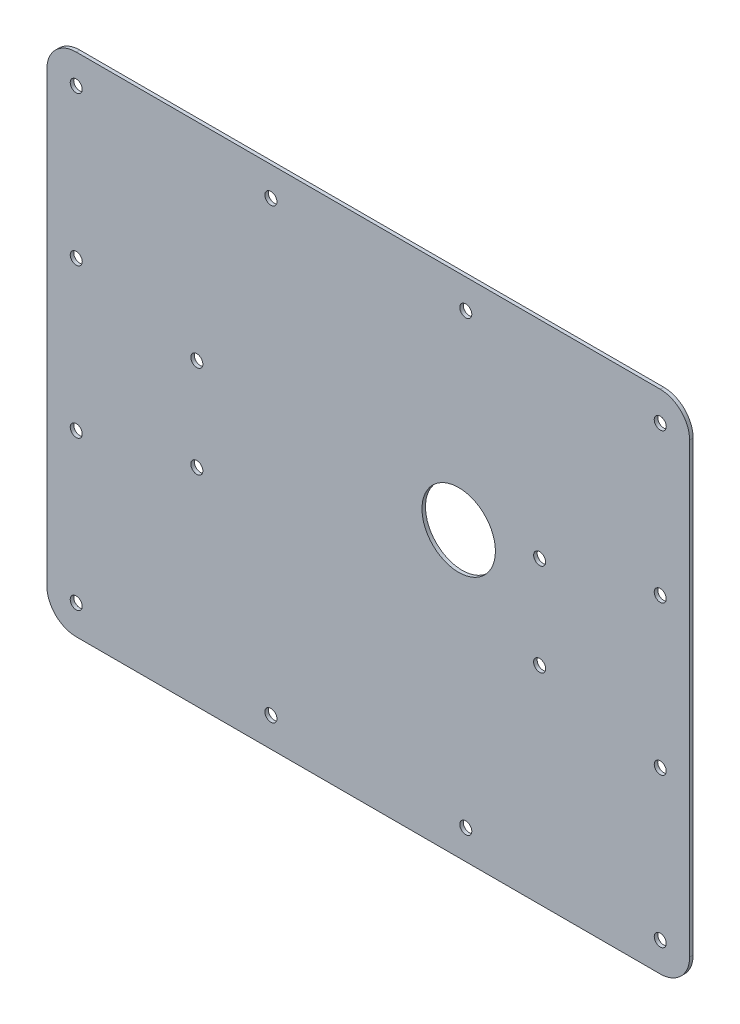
SolidWorks part; units mm, degrees
ref_plane "Front" through (0, 0, 0) normal (0, 0, 1) x (1, 0, 0)
ref_plane "Top" through (0, 0, 0) normal (0, 1, 0) x (1, 0, 0)
ref_plane "Right" through (0, 0, 0) normal (1, 0, 0) x (0, 0, -1)
sketch "Sketch1" plane through (0, 0, 0) normal (0, 0, 1) x (1, 0, 0)
  line L0 (-138.938, 0) -> (138.938, 0) construction
  line L1 (-126.238, 109.474) -> (126.238, 109.474)
  line L2 (-138.938, 96.774) -> (-138.938, -96.774)
  line L3 (-126.238, -109.474) -> (126.238, -109.474)
  line L4 (138.938, 96.774) -> (138.938, -96.774)
  line L5 (-138.938, 109.474) -> (138.938, -109.474) construction
  line L6 (-138.938, -109.474) -> (138.938, 109.474) construction
  line L7 (0, 109.474) -> (0, -109.474) construction
  circle A0 centre (39.1, 13.2) radius 15.875
  circle A1 centre (-74.1, -20) radius 2.6
  circle A2 centre (74.1, -20) radius 2.6
  circle A3 centre (74.1, 20) radius 2.6
  circle A4 centre (-74.1, 20) radius 2.6
  arc A15 (138.938, 96.774) -> (126.238, 109.474) centre (126.238, 96.774) ccw
  arc A16 (138.938, -96.774) -> (126.238, -109.474) centre (126.238, -96.774) cw
  arc A17 (-126.238, -109.474) -> (-138.938, -96.774) centre (-126.238, -96.774) cw
  arc A18 (-138.938, 96.774) -> (-126.238, 109.474) centre (-126.238, 96.774) cw
  circle A19 centre (-126.238, -96.774) radius 2.6
  circle A20 centre (126.238, -96.774) radius 2.6
  circle A21 centre (126.238, 96.774) radius 2.6
  circle A22 centre (-126.238, 96.774) radius 2.6
  circle A23 centre (-126.238, -32.258) radius 2.6
  circle A24 centre (-126.238, 32.258) radius 2.6
  circle A25 centre (126.238, -32.258) radius 2.6
  circle A26 centre (126.238, 32.258) radius 2.6
  circle A27 centre (-42.0793, -96.774) radius 2.6
  circle A29 centre (42.164, -96.774) radius 2.6
  circle A30 centre (42.164, 96.774) radius 2.6
  circle A31 centre (-42.0793, 96.774) radius 2.6
  point P0 (0, 0)
  dimension "D3" = 5.2
  dimension "D7" = 5.2
  dimension "D8" = 31.75
  dimension "D9" = 33.2
  dimension "D10" = 35
  dimension "D13" = 12.7
  dimension "D11" = 12.7
  dimension "D14" = 64.516
  dimension "D15" = 64.516
  dimension "D17" = 12.7
  dimension "D18" = 5.2
  dimension "D19" = 5.2
  dimension "D20" = 5.2
  dimension "D21" = 12.7
  dimension "D22" = 84.1587
  dimension "D23" = 84.1587
  dimension "D24" = 12.7
  dimension "D25" = 5.2
  dimension "D26" = 64.516
  dimension "D27" = 64.516
  dimension "D28" = 64.516
  dimension "D29" = 84.2433
  dimension "D30" = 84.2433
  dimension "D1" = 277.876
  dimension "D2" = 218.948
  dimension "D4" = 20
  dimension "D12" = 12.7
  dimension "D16" = 12.7
  dimension "D5" = 2
  dimension "D6" = 2
extrude "Boss-Extrude1" add sketch "Sketch1" along normal blind 1.5189
